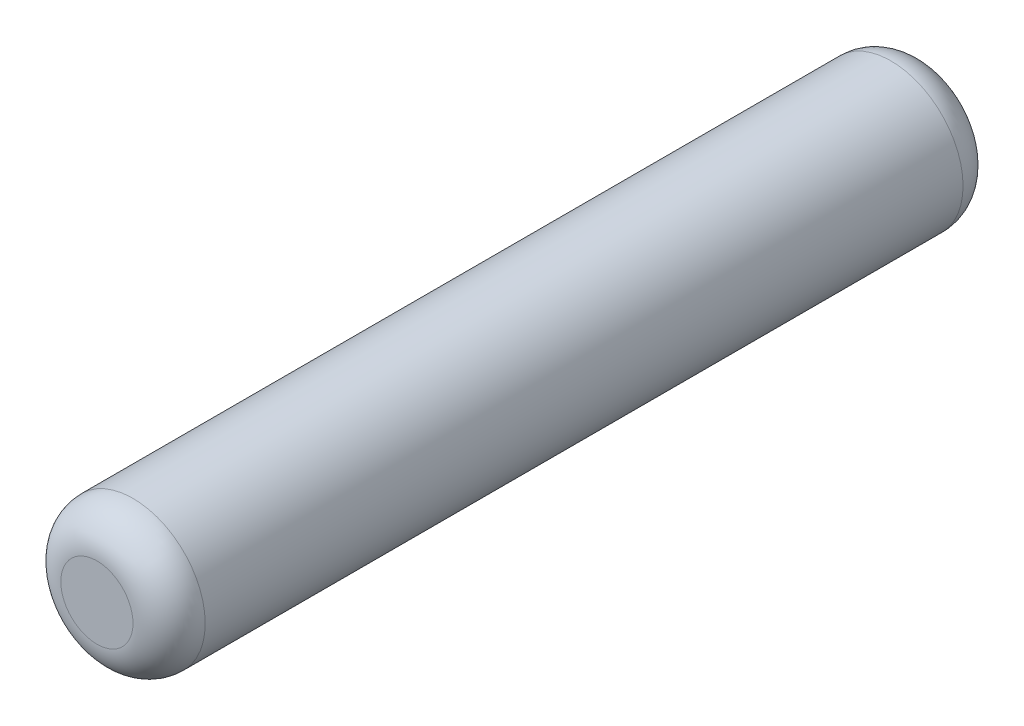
SolidWorks part; units mm, degrees
ref_plane "Plan1" through (0, 0, 0) normal (0, 0, 1) x (1, 0, 0)
ref_plane "Plan2" through (0, 0, 0) normal (0, 1, 0) x (1, 0, 0)
ref_plane "Plan3" through (0, 0, 0) normal (1, 0, 0) x (0, 0, -1)
sketch "Esquisse1" plane through (0, 0, 0) normal (0, 0, 1) x (1, 0, 0)
  circle A0 centre (0, 0) radius 1
  dimension "D1" = 2
extrude "Base-Extrusion" add sketch "Esquisse1" along normal mid plane 11.5
fillet "Congé1" radius 0.5
